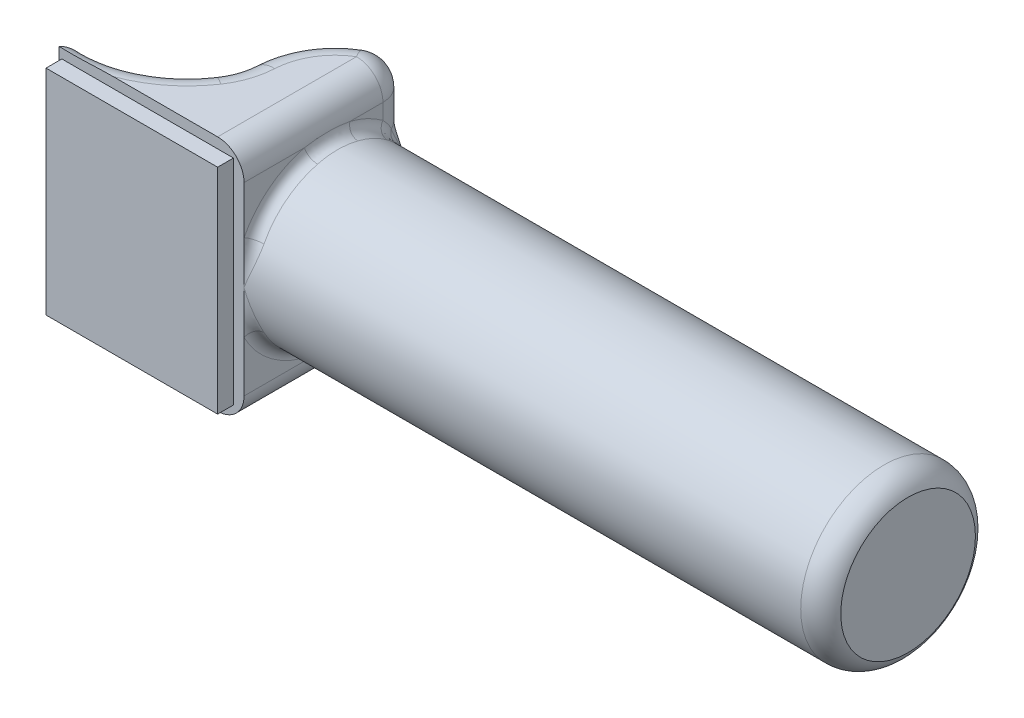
SolidWorks part; units mm, degrees
ref_plane "Front Plane" through (0, 0, 0) normal (0, 0, 1) x (1, 0, 0)
ref_plane "Top Plane" through (0, 0, 0) normal (0, 1, 0) x (1, 0, 0)
ref_plane "Right Plane" through (0, 0, 0) normal (1, 0, 0) x (0, 0, -1)
sketch "Sketch1" plane through (0, 0, 0) normal (1, 0, 0) x (0, 0, -1)
  circle A0 centre (0, 0) radius 12.75
  circle A1 centre (0, 0) radius 15.75
  dimension "D1" = 25.5
  dimension "D2" = 3
extrude "Boss-Extrude1" add sketch "Sketch1" along normal blind 110
ref_plane "Plane1" through (0, 0, 15.75) normal (0, 0, 1) x (1, 0, 0)
sketch "Sketch2" plane through (0, 0, 15.75) normal (0, 0, 1) x (1, 0, 0)
  line L0 (-26.6228, 0) -> (110, 0) construction
  line L1 (110, -15.75) -> (110, 15.75) construction
  line L2 (0, 15.75) -> (0, -15.75) construction
  line L3 (-31.5, 17.25) -> (-5, 17.25) construction
  line L4 (-31.5, 17.25) -> (-31.5, -17.25) construction
  line L5 (-31.5, -17.25) -> (-5, -17.25) construction
  line L6 (-5, 17.25) -> (-5, -17.25) construction
  line L7 (-31.5, 17.25) -> (-5, -17.25) construction
  line L8 (-31.5, -17.25) -> (-5, 17.25) construction
  line L10 (-34.5, 20.25) -> (-2, 20.25)
  line L11 (-34.5, 20.25) -> (-34.5, -20.25)
  line L12 (-34.5, -20.25) -> (-2, -20.25)
  line L13 (-2, 20.25) -> (-2, -20.25)
  line L14 (-34.5, 20.25) -> (-2, -20.25) construction
  line L15 (-34.5, -20.25) -> (-2, 20.25) construction
  line L16 (-32, 17.75) -> (-4.5, 17.75)
  line L17 (-32, 17.75) -> (-32, -17.75)
  line L18 (-32, -17.75) -> (-4.5, -17.75)
  line L19 (-4.5, 17.75) -> (-4.5, -17.75)
  line L20 (-32, 17.75) -> (-4.5, -17.75) construction
  line L21 (-32, -17.75) -> (-4.5, 17.75) construction
  point P4 (-18.25, 0)
  point P9 (-18.25, 0)
  point P12 (-18.25, 0)
  point P21 (-18.25, -20.25)
  dimension "D1" = 26.5
  dimension "D2" = 34.5
  dimension "D3" = 5
  dimension "D4" = 3
  dimension "D5" = 3
  dimension "D6" = 2.5
  dimension "D7" = 2.5
ref_plane "Plane2" through (-17.5103, 0, 0) normal (-1, 0, 0) x (0, 0, 1)
extrude "Boss-Extrude3" add sketch "Sketch2" along normal blind 3 separate body contours L13 L12 L11 L10
sketch "Sketch4" plane through (0, 0, 15.75) normal (0, 0, -1) x (-1, 0, 0)
  line L0 (0, -15.75) -> (0, 15.75) construction
  line L1 (0, 22.2215) -> (35.0205, 22.2215)
  line L2 (0, 22.2215) -> (0, -22.7785)
  line L3 (0, -22.7785) -> (35.0205, -22.7785)
  line L4 (35.0205, 22.2215) -> (35.0205, -22.7785)
  line L5 (0, 22.2215) -> (35.0205, -22.7785) construction
  line L6 (0, -22.7785) -> (35.0205, 22.2215) construction
  point P0 (17.5103, -0.2785)
  dimension "D1" = 45
extrude "Boss-Extrude4" add sketch "Sketch4" along normal blind 33
sketch "Sketch5" plane through (0, 0, 0) normal (1, 0, 0) x (0, 0, -1)
  circle A1 centre (0, 0) radius 12.75
  circle A2 centre (0, 0) radius 12.75
  dimension "D1" = 0
extrude "Cut-Extrude1" cut sketch "Sketch5" against normal up to surface (35.0205 mm away)
sketch "Sketch6" plane through (0, 22.2215, 0) normal (0, 1, 0) x (1, 0, 0)
  line L0 (-35.0205, 17.25) -> (-35.0205, -15.75) construction
  line L1 (0, 17.25) -> (-35.0205, 17.25)
  line L2 (-35.0205, 17.25) -> (-35.0205, -12.0685)
  arc A0 (-35.0205, -12.0685) -> (-15.7675, -0.8403) centre (-32.9025, 6.4205) ccw
  arc A1 (-15.7675, -0.8403) -> (0, 17.25) centre (1.2414, 0.2514) cw
extrude "Cut-Extrude2" cut sketch "Sketch6" against normal up to surface (45 mm away)
fillet "Fillet1" radius 10 2 edges at (-15.7675, -17.7504, 0.8403) (-15.7675, 17.4719, 0.8403)
fillet "Fillet2" radius 5 2 edges at (0, -22.7785, -0.75) (0, 22.2215, -0.75)
fillet "Fillet3" radius 5 9 edges at (-25.124, 22.2215, 10.4858) (-16.2831, 22.2215, 1.5659) (-25.124, -22.7785, 10.4858) (-16.2831, -22.7785, 1.5659) (-12.6017, -22.7785, -10.1943) (-1.0836, -20.8869, -17.1359) (0, -0.2785, -17.25) (-1.902, 21.1461, -17.0029) (-12.6017, 22.2215, -10.1943)
fillet "Fillet4" radius 5 1 edges at (-35.0205, 10.6671, 12.0685)
fillet "Fillet5" radius 5 1 edges at (110, 0, -15.75)
fillet "Fillet6" radius 2 6 edges at (-16.3301, -12.6357, 1.7034) (-26.9313, -6.0828, 11.2054) (-32.7616, 0.3162, 12.7461) (-22.0426, 9.3279, 8.6921) (-16.2509, 12.6652, 1.4679) (-10.3626, 0.6177, -12.735)
fillet "Fillet7" radius 2 3 edges at (0, 0, -15.75) (0, -14.3919, 6.3981) (0, 14.3919, 6.3981)
ref_plane "Plane3" through (110, 0, 0) normal (1, 0, 0) x (0, 0, -1)
sketch "Sketch7" plane through (110, 0, 0) normal (1, 0, 0) x (0, 0, -1)
  circle A0 centre (0, 0) radius 12.75
  dimension "D1" = 25.5
extrude "Boss-Extrude5" add sketch "Sketch7" against normal blind 3
fillet "Fillet8" radius 5 1 edges at (107, 0, -12.75)
